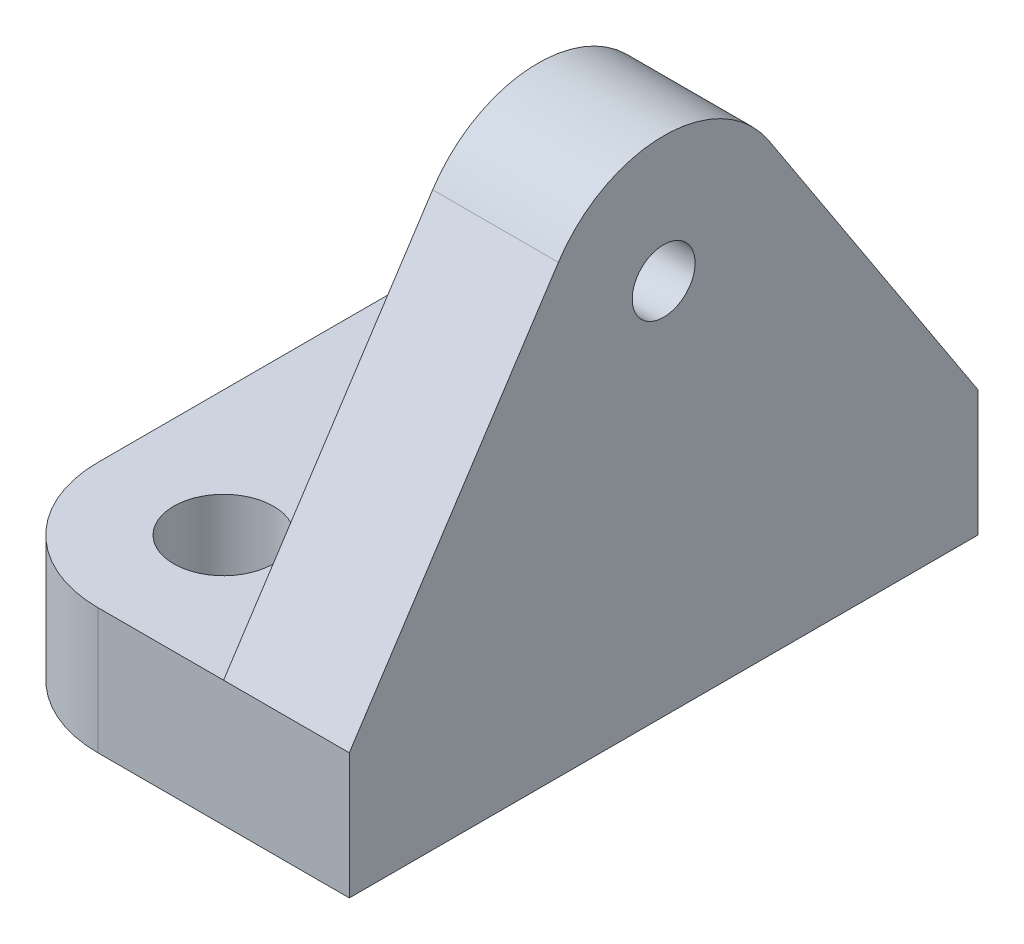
SolidWorks part; units mm, degrees
ref_plane "Front Plane" through (0, 0, 0) normal (0, 0, 1) x (1, 0, 0)
ref_plane "Top Plane" through (0, 0, 0) normal (0, 1, 0) x (1, 0, 0)
ref_plane "Right Plane" through (0, 0, 0) normal (1, 0, 0) x (0, 0, -1)
sketch "Sketch1" plane through (0, 0, 0) normal (0, 1, 0) x (1, 0, 0)
  line L1 (12.7, 0) -> (38.1, 0)
  line L2 (0, 12.7) -> (0, 50.8)
  line L3 (12.7, 63.5) -> (38.1, 63.5)
  line L4 (38.1, 0) -> (38.1, 63.5)
  arc A0 (0, 50.8) -> (12.7, 63.5) centre (12.7, 50.8) cw
  arc A1 (12.7, 0) -> (0, 12.7) centre (12.7, 12.7) cw
  point P7 (0, 63.5)
  point P10 (0, 0)
  dimension "D3" = 12.7
  dimension "D1" = 63.5
  dimension "D2" = 38.1
extrude "Extrude1" add sketch "Sketch1" against normal blind 12.7
sketch "Sketch3" plane through (38.1, 0, 0) normal (1, 0, 0) x (0, 0, -1)
  line L0 (31.75, 0) -> (31.75, 25.4) construction
  line L1 (0, 0) -> (63.5, 0) construction
  line L2 (0, 0) -> (21.1157, 32.3428)
  line L3 (63.5, 0) -> (42.3843, 32.3428)
  line L4 (0, 0) -> (63.5, 0)
  arc A0 (42.3843, 32.3428) -> (21.1157, 32.3428) centre (31.75, 25.4) ccw
  circle A1 centre (31.75, 25.4) radius 3.175
  dimension "D2" = 25.4
  dimension "D3" = 6.35
  dimension "D1" = 25.4
extrude "Extrude2" add sketch "Sketch3" against normal blind 12.7
hole_wizard "3/8 Clearance Hole1" positions "Sketch5" profile "Sketch4" hole size "3/8" standard "Ansi Inch"
sketch "Sketch5" plane through (0, -12.7, 0) normal (0, -1, 0) x (1, 0, 0)
  line L0 (38.1, -63.5) -> (12.7, -63.5) construction
  line L1 (0, -50.8) -> (0, -12.7) construction
  line L2 (12.7, 0) -> (38.1, 0) construction
  point P0 (12.7, -50.8)
  point P1 (12.7, -12.7)
  dimension "D1" = 12.7
  dimension "D2" = 12.7
  dimension "D3" = 12.7
  dimension "D4" = 12.7
sketch "Sketch4" plane through (12.7, -12.7, -50.8) normal (1, 0, 0) x (0, 0, -1)
  line L0 (0, 0) -> (0, 50.8)
  line L1 (0, 50.8) -> (5.0419, 50.8)
  line L2 (5.0419, 50.8) -> (5.0419, 0)
  line L5 (5.0419, 0) -> (0, 0)
  line L11 (0, -6.35) -> (0, 107.95) construction
  dimension "Thru Hole Dia." = 10.0838
  dimension "Thru Hole Depth" = 50.8
